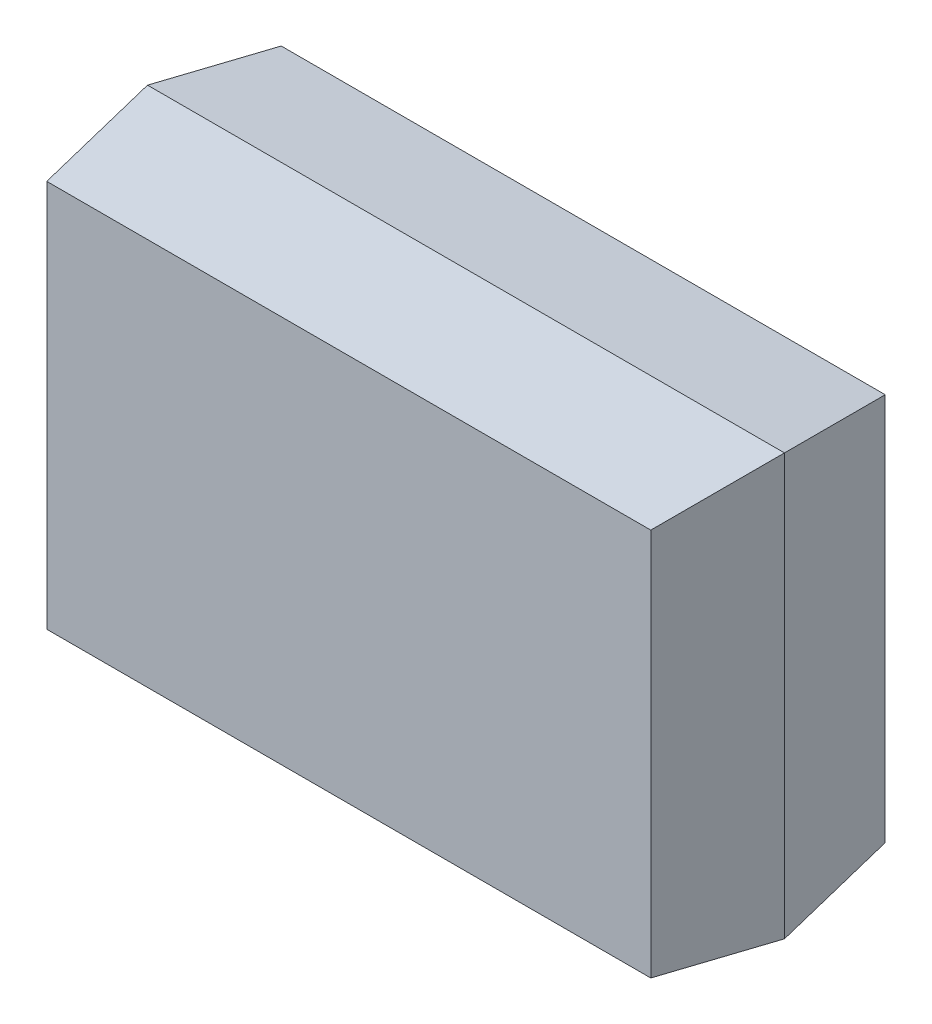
SolidWorks part; units mm, degrees
ref_plane "Vorne" through (0, 0, 0) normal (0, 0, 1) x (1, 0, 0)
ref_plane "Oben" through (0, 0, 0) normal (0, 1, 0) x (1, 0, 0)
ref_plane "Rechts" through (0, 0, 0) normal (1, 0, 0) x (0, 0, -1)
sketch "Skizze1" plane through (0, 0, 0) normal (0, 0, 1) x (1, 0, 0)
  line L1 (-38.21, 51.675) -> (69.1005, 51.675)
  line L2 (-38.21, 51.675) -> (-38.21, -19.2266)
  line L3 (-38.21, -19.2266) -> (69.1005, -19.2266)
  line L4 (69.1005, 51.675) -> (69.1005, -19.2266)
extrude "Linear austragen1" add sketch "Skizze1" along normal blind 39.5
ref_plane "Ebene1" through (0, 0, 19.75) normal (0, 0, 1) x (1, 0, 0)
draft "Formschräge2" type of draft neutral plane draft angle 8 neutral plane "Ebene1" faces to draft 4 parameters "D1"=8
draft "Formschräge3" type of draft neutral plane draft angle 8 neutral plane "Ebene1" faces to draft 4 parameters "D1"=8
